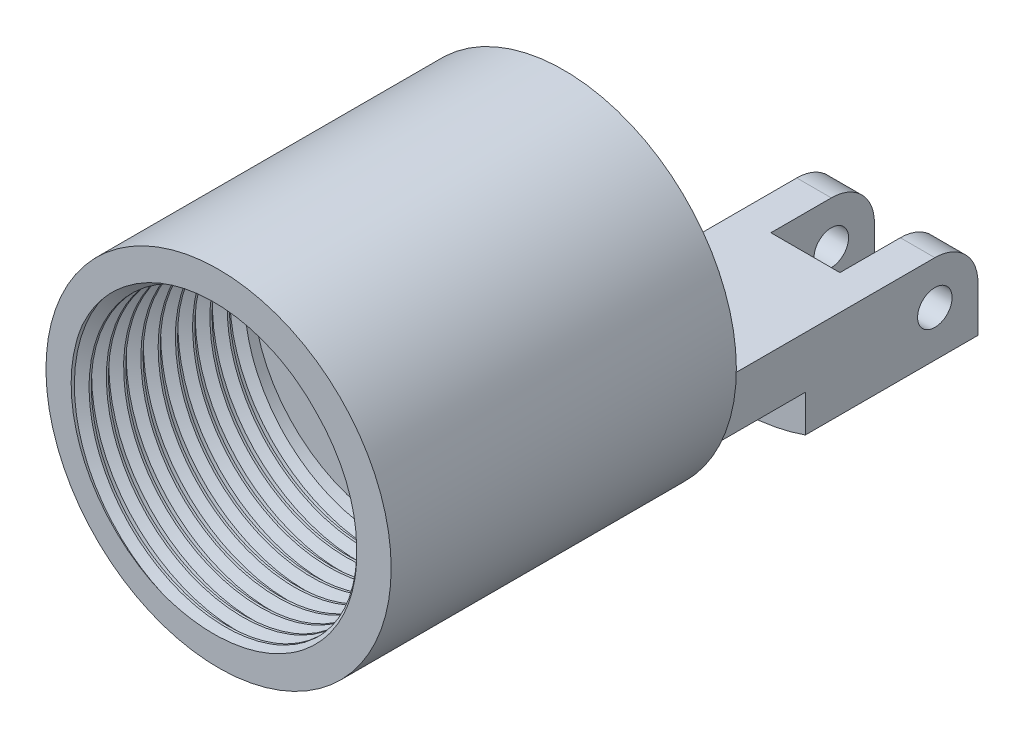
SolidWorks part; units mm, degrees
ref_plane "Alzado" through (0, 0, 0) normal (0, 0, 1) x (1, 0, 0)
ref_plane "Planta" through (0, 0, 0) normal (0, 1, 0) x (1, 0, 0)
ref_plane "Vista lateral" through (0, 0, 0) normal (1, 0, 0) x (0, 0, -1)
sketch "Sketch1" plane through (0, 0, 0) normal (0, 0, 1) x (1, 0, 0)
  circle A0 centre (0, 0) radius 10
  dimension "D1" = 20
extrude "Boss-Extrude1" add sketch "Sketch1" along normal blind 30
sketch "Sketch2" plane through (0, 0, 30) normal (0, 0, 1) x (1, 0, 0)
  circle A0 centre (0, 0) radius 8
  dimension "D1" = 16
extrude "Cut-Extrude1" cut sketch "Sketch2" against normal blind 10
thread "Thread1" pitch 1 start angle 0, offset 0, length 10, pitch 1, diameter 16
ref_plane "Plane1" through (8, 0, 20) normal (0, -1, 0) x (1, 0, 0)
sketch "Thread Profile1" plane through (8, 0, 20) normal (0, -1, 0) x (1, 0, 0)
  line L0 (0, 0) -> (0, 1) construction
  line L11 (0, 0.875) -> (0, 0)
  line L12 (0, 0) -> (0.5413, 0.3125)
  line L13 (0.5413, 0.3125) -> (0.5413, 0.5625)
  line L15 (0.5413, 0.5625) -> (0, 0.875)
  line L17 (0.5413, 0.4375) -> (0, 0.4375) construction
  point P3 (0, 0)
  dimension "Pitch" = 1
  dimension "Profile_Angle" = 60
  dimension "Profile_Land" = 0.25
  dimension "Profile_Height" = 0.5413
sketch "Sketch6" plane through (0, 0, 0) normal (0, 0, -1) x (-1, 0, 0)
  circle A0 centre (0, 0) radius 12
  dimension "D1" = 24
extrude "Boss-Extrude2" add sketch "Sketch6" along normal blind 10
sketch "Sketch7" plane through (0, 0, 0) normal (0, 1, 0) x (1, 0, 0)
  line L0 (0, 0) -> (0, 10) construction
  line L1 (12, 10) -> (4, 10)
  line L2 (12, 10) -> (12, -10)
  line L3 (12, -10) -> (4, -10)
  line L4 (4, 10) -> (4, -10)
  line L5 (12, 10) -> (-12, 10) construction
  line L6 (-4, 10) -> (-4, -10)
  line L7 (-12, -10) -> (-4, -10)
  line L8 (-12, 10) -> (-12, -10)
  line L9 (-12, 10) -> (-4, 10)
  dimension "D1" = 4
  dimension "D2" = 20
extrude "Cut-Extrude3" cut sketch "Sketch7" against normal up to next and the other way through all
sketch "Sketch8" plane through (4, 0, 0) normal (1, 0, 0) x (0, 0, -1)
  line L0 (-10, 9.1652) -> (-10, -9.1652) construction
  line L1 (10, 12) -> (-10, 12)
  line L2 (10, 12) -> (10, -6.1652)
  line L3 (10, -6.1652) -> (-10, -6.1652)
  line L4 (-10, 12) -> (-10, -6.1652)
  line L5 (-10, -9.1652) -> (0, -9.1652) construction
  dimension "D1" = 3
extrude "Cut-Extrude4" cut sketch "Sketch8" against normal up to next
sketch "Sketch9" plane through (0, -6.1652, 0) normal (0, 1, 0) x (1, 0, 0)
  line L1 (0, 0) -> (0, 10) construction
  line L2 (-4, 10) -> (4, 10) construction
  line L3 (-2, 10) -> (2, 10)
  line L4 (2, 10) -> (2, 4)
  line L5 (2, 4) -> (-2, 4)
  line L6 (-2, 10) -> (-2, 4)
  point P9 (0, 4)
  dimension "D1" = 2
  dimension "D2" = 6
extrude "Cut-Extrude5" cut sketch "Sketch9" against normal up to next
sketch "Sketch10" plane through (4, 0, 0) normal (1, 0, 0) x (0, 0, -1)
  line L0 (10, -6.1652) -> (10, -11.3137) construction
  line L1 (-10, -6.1652) -> (10, -6.1652) construction
  circle A0 centre (7.5, -8.6652) radius 1
  dimension "D3" = 2
  dimension "D1" = 2.5
  dimension "D2" = 2.5
extrude "Cut-Extrude6" cut sketch "Sketch10" against normal through all
fillet "Fillet1" radius 2.5 3 edges at (0, -6.1652, 10) (-3, -6.1652, -10) (3, -6.1652, -10)
